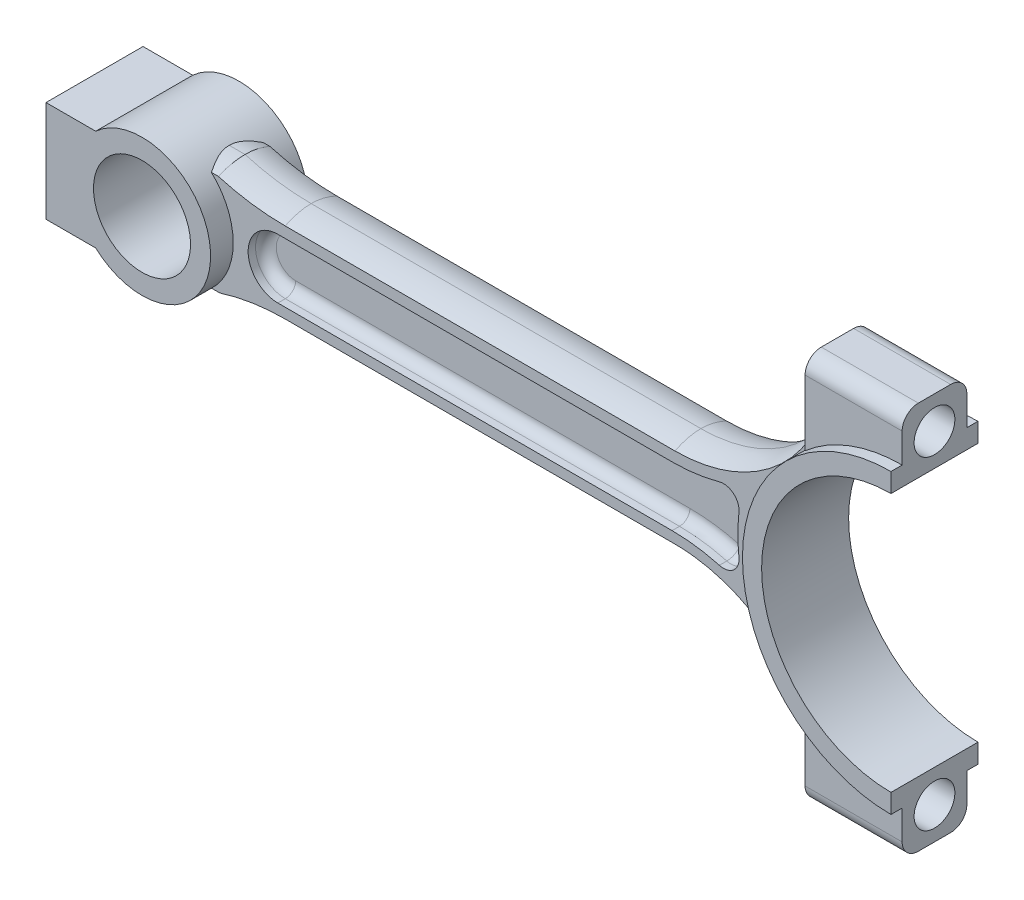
SolidWorks part; units mm, degrees
ref_plane "XY" through (0, 0, 0) normal (0, 0, 1) x (1, 0, 0)
ref_plane "YZ" through (0, 0, 0) normal (0, 1, 0) x (1, 0, 0)
ref_plane "XZ" through (0, 0, 0) normal (1, 0, 0) x (0, 0, -1)
imported_body "Imported1"
mirror "Mirror1"
hole_wizard "Ø8.0 (8) Diameter Hole1" positions "Sketch2" profile "Sketch1" hole size "Ø8.0" standard "Ansi Metric"
sketch "Sketch2" plane through (-38.3637, 0, 0) normal (-1, 0, 0) x (0, 0, 1)
  point P0 (80.7441, 31.555)
  point P1 (80.7441, -31.945)
sketch "Sketch1" plane through (-38.3637, 31.555, 80.7441) normal (0, 1, 0) x (0, 0, 1)
  line L0 (0, 0) -> (0, 22.7234)
  line L1 (0, 22.7234) -> (4, 20.32)
  line L2 (4, 20.32) -> (4, 0)
  line L5 (4, 0) -> (0, 0)
  line L10 (0, 22.7234) -> (-4, 20.32) construction
  line L11 (0, -6.35) -> (0, 107.95) construction
  dimension "Hole Dia." = 8
  dimension "Hole Depth" = 20.32
  dimension "Drill Angle" = 118
sketch "Sketch3" plane through (0, 0, 0) normal (0, 1, 0) x (1, 0, 0)
  line L0 (-48.4729, -71.2191) -> (-48.4729, -75.6641) construction
  line L1 (-19.3137, -71.2191) -> (-48.4729, -71.2191)
  line L2 (-19.3137, -71.2191) -> (-19.3137, -72.2034)
  line L3 (-19.3137, -72.2034) -> (-48.4729, -72.2034)
  line L4 (-48.4729, -71.2191) -> (-48.4729, -72.2034)
  line L5 (-19.3137, -80.7441) -> (-13.5164, -80.7441) construction
  line L6 (-19.3137, -83.9191) -> (-19.3137, -77.5691) construction
  line L7 (-48.4729, -90.2691) -> (-48.4729, -89.2849)
  line L8 (-19.3137, -89.2849) -> (-48.4729, -89.2849)
  line L9 (-19.3137, -90.2691) -> (-19.3137, -89.2849)
  line L10 (-19.3137, -90.2691) -> (-48.4729, -90.2691)
  dimension "D1" = 0.9842
extrude "Cut-Extrude1" cut sketch "Sketch3" against normal mid plane 116.586
